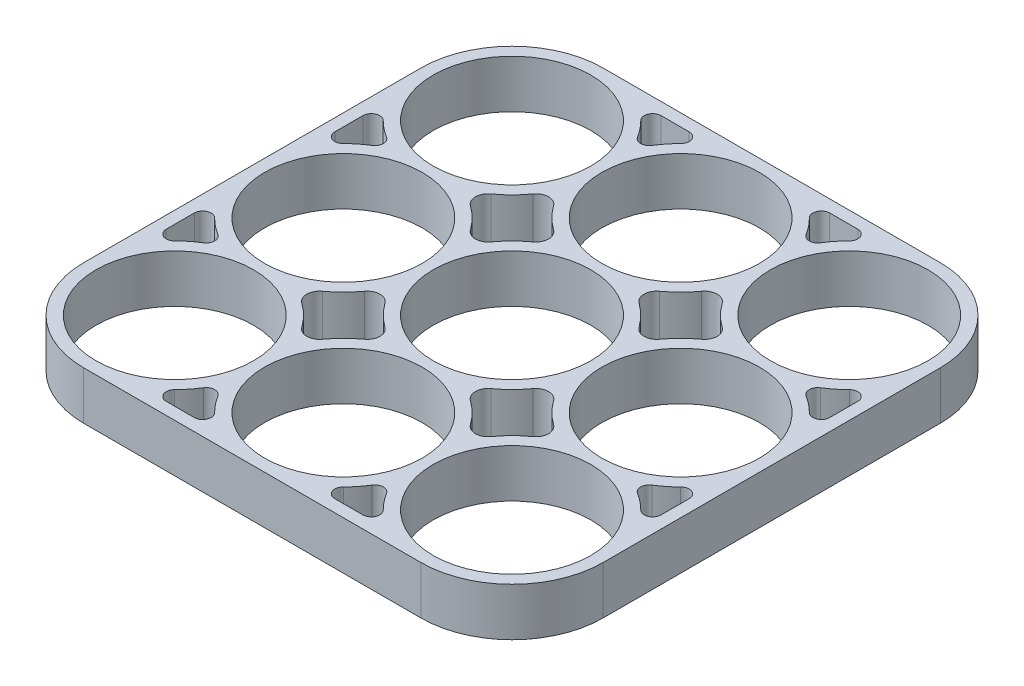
SolidWorks part; units mm, degrees
ref_plane "Ebene vorne" through (0, 0, 0) normal (0, 0, 1) x (1, 0, 0)
ref_plane "Ebene oben" through (0, 0, 0) normal (0, 1, 0) x (1, 0, 0)
ref_plane "Ebene rechts" through (0, 0, 0) normal (1, 0, 0) x (0, 0, -1)
sketch "Skizze1" plane through (0, 0, 0) normal (0, 1, 0) x (1, 0, 0)
  line L0 (-50, 0) -> (50, 0) construction
  line L1 (0, -50) -> (0, 50) construction
  line L2 (-30.8, 20) -> (-30.8, -20)
  line L3 (-30.8, -20) -> (-29.35, -20)
  line L4 (-29.35, 11.6623) -> (-29.35, 8.3377)
  line L5 (-29.35, -8.3377) -> (-29.35, -11.6623)
  line L6 (-20, -30.8) -> (20, -30.8)
  line L7 (-11.6623, -29.35) -> (-8.3377, -29.35)
  line L8 (8.3377, -29.35) -> (11.6623, -29.35)
  line L9 (-20, 30.8) -> (20, 30.8)
  line L10 (-11.6623, 29.35) -> (-8.3377, 29.35)
  line L11 (8.3377, 29.35) -> (11.6623, 29.35)
  line L12 (30.8, 20) -> (30.8, -20)
  line L14 (29.35, -11.6623) -> (29.35, -8.3377)
  line L15 (29.35, 8.3377) -> (29.35, 11.6623)
  arc A1 (-13.7117, -8.7805) -> (-11.2195, -6.2883) centre (-20, 0) ccw
  arc A2 (-25.7333, -10.8475) -> (-27.6424, -12.3689) centre (-20, -20) ccw
  arc A3 (6.2883, 11.2195) -> (8.7805, 13.7117) centre (0, 20) ccw
  arc A4 (6.2883, -8.7805) -> (8.7805, -6.2883) centre (0, 0) ccw
  arc A5 (-9.1525, -25.7333) -> (-7.6311, -27.6424) centre (0, -20) ccw
  arc A6 (11.2195, 13.7117) -> (13.7117, 11.2195) centre (20, 20) ccw
  arc A7 (25.7333, -9.1525) -> (27.6424, -7.6311) centre (20, 0) ccw
  arc A8 (10.8475, -25.7333) -> (12.3689, -27.6424) centre (20, -20) ccw
  circle A9 centre (-20, 20) radius 9.35
  circle A10 centre (-20, 0) radius 9.35
  circle A11 centre (-20, -20) radius 9.35
  circle A12 centre (0, -20) radius 9.35
  circle A13 centre (0, 0) radius 9.35
  circle A14 centre (0, 20) radius 9.35
  circle A15 centre (20, 20) radius 9.35
  circle A16 centre (20, 0) radius 9.35
  circle A17 centre (20, -20) radius 9.35
  arc A18 (-11.2195, -13.7117) -> (-13.7117, -11.2195) centre (-20, -20) ccw
  arc A19 (8.7805, -13.7117) -> (6.2883, -11.2195) centre (0, -20) ccw
  arc A20 (13.7117, -11.2195) -> (11.2195, -13.7117) centre (20, -20) ccw
  arc A21 (-6.2883, -11.2195) -> (-8.7805, -13.7117) centre (0, -20) ccw
  arc A22 (-25.7333, 9.1525) -> (-27.6424, 7.6311) centre (-20, 0) ccw
  arc A23 (-13.7117, 11.2195) -> (-11.2195, 13.7117) centre (-20, 20) ccw
  arc A24 (-11.2195, 6.2883) -> (-13.7117, 8.7805) centre (-20, 0) ccw
  arc A25 (-8.7805, -6.2883) -> (-6.2883, -8.7805) centre (0, 0) ccw
  arc A26 (8.7805, 6.2883) -> (6.2883, 8.7805) centre (0, 0) ccw
  arc A27 (11.2195, -6.2883) -> (13.7117, -8.7805) centre (20, 0) ccw
  arc A28 (-6.2883, 8.7805) -> (-8.7805, 6.2883) centre (0, 0) ccw
  arc A29 (-10.8475, 25.7333) -> (-12.3689, 27.6424) centre (-20, 20) ccw
  arc A30 (-8.7805, 13.7117) -> (-6.2883, 11.2195) centre (0, 20) ccw
  arc A31 (9.1525, 25.7333) -> (7.6311, 27.6424) centre (0, 20) ccw
  arc A32 (13.7117, 8.7805) -> (11.2195, 6.2883) centre (20, 0) ccw
  arc A33 (25.7333, 10.8475) -> (27.6424, 12.3689) centre (20, 20) ccw
  arc A34 (-27.6424, 12.3689) -> (-25.7333, 10.8475) centre (-20, 20) ccw
  arc A35 (-27.6424, -7.6311) -> (-25.7333, -9.1525) centre (-20, 0) ccw
  arc A36 (-30.8, -20) -> (-20, -30.8) centre (-20, -20) ccw
  arc A37 (-12.3689, -27.6424) -> (-10.8475, -25.7333) centre (-20, -20) ccw
  arc A38 (7.6311, -27.6424) -> (9.1525, -25.7333) centre (0, -20) ccw
  arc A39 (20, -30.8) -> (30.8, -20) centre (20, -20) ccw
  arc A40 (-20, 30.8) -> (-30.8, 20) centre (-20, 20) ccw
  arc A41 (-7.6311, 27.6424) -> (-9.1525, 25.7333) centre (0, 20) ccw
  arc A42 (12.3689, 27.6424) -> (10.8475, 25.7333) centre (20, 20) ccw
  arc A43 (30.8, 20) -> (20, 30.8) centre (20, 20) ccw
  arc A44 (27.6424, 7.6311) -> (25.7333, 9.1525) centre (20, 0) ccw
  arc A45 (27.6424, -12.3689) -> (25.7333, -10.8475) centre (20, -20) ccw
  arc A46 (9.1525, 25.7333) -> (10.8475, 25.7333) centre (10, 26.2642) ccw
  arc A47 (12.3689, 27.6424) -> (11.6623, 29.35) centre (11.6623, 28.35) ccw
  arc A48 (8.3377, 29.35) -> (7.6311, 27.6424) centre (8.3377, 28.35) ccw
  arc A49 (-11.6623, 29.35) -> (-12.3689, 27.6424) centre (-11.6623, 28.35) ccw
  arc A50 (-7.6311, 27.6424) -> (-8.3377, 29.35) centre (-8.3377, 28.35) ccw
  arc A51 (-9.1525, 25.7333) -> (-10.8475, 25.7333) centre (-10, 26.2642) cw
  arc A52 (27.6424, 7.6311) -> (29.35, 8.3377) centre (28.35, 8.3377) ccw
  arc A53 (29.35, 11.6623) -> (27.6424, 12.3689) centre (28.35, 11.6623) ccw
  arc A54 (25.7333, 10.8475) -> (25.7333, 9.1525) centre (26.2642, 10) ccw
  arc A55 (27.6424, -12.3689) -> (29.35, -11.6623) centre (28.35, -11.6623) ccw
  arc A56 (29.35, -8.3377) -> (27.6424, -7.6311) centre (28.35, -8.3377) ccw
  arc A57 (25.7333, -10.8475) -> (25.7333, -9.1525) centre (26.2642, -10) cw
  arc A58 (-8.3377, -29.35) -> (-7.6311, -27.6424) centre (-8.3377, -28.35) ccw
  arc A59 (-11.6623, -29.35) -> (-12.3689, -27.6424) centre (-11.6623, -28.35) cw
  arc A60 (8.3377, -29.35) -> (7.6311, -27.6424) centre (8.3377, -28.35) cw
  arc A61 (11.6623, -29.35) -> (12.3689, -27.6424) centre (11.6623, -28.35) ccw
  arc A62 (10.8475, -25.7333) -> (9.1525, -25.7333) centre (10, -26.2642) ccw
  arc A63 (-9.1525, -25.7333) -> (-10.8475, -25.7333) centre (-10, -26.2642) ccw
  arc A64 (-27.6424, -12.3689) -> (-29.35, -11.6623) centre (-28.35, -11.6623) cw
  arc A65 (-25.7333, -10.8475) -> (-25.7333, -9.1525) centre (-26.2642, -10) ccw
  arc A66 (-27.6424, -7.6311) -> (-29.35, -8.3377) centre (-28.35, -8.3377) ccw
  arc A67 (-27.6424, 7.6311) -> (-29.35, 8.3377) centre (-28.35, 8.3377) cw
  arc A68 (-25.7333, 9.1525) -> (-25.7333, 10.8475) centre (-26.2642, 10) ccw
  arc A69 (-29.35, 11.6623) -> (-27.6424, 12.3689) centre (-28.35, 11.6623) cw
  arc A70 (11.2195, -13.7117) -> (8.7805, -13.7117) centre (10, -12.8383) cw
  arc A71 (13.7117, -11.2195) -> (13.7117, -8.7805) centre (12.8383, -10) ccw
  arc A72 (6.2883, -11.2195) -> (6.2883, -8.7805) centre (7.1617, -10) cw
  arc A73 (11.2195, 6.2883) -> (8.7805, 6.2883) centre (10, 7.1617) cw
  arc A74 (13.7117, 8.7805) -> (13.7117, 11.2195) centre (12.8383, 10) ccw
  arc A75 (6.2883, 8.7805) -> (6.2883, 11.2195) centre (7.1617, 10) cw
  arc A76 (11.2195, 13.7117) -> (8.7805, 13.7117) centre (10, 12.8383) ccw
  arc A77 (11.2195, -6.2883) -> (8.7805, -6.2883) centre (10, -7.1617) ccw
  arc A78 (-6.2883, -11.2195) -> (-6.2883, -8.7805) centre (-7.1617, -10) ccw
  arc A79 (-13.7117, -11.2195) -> (-13.7117, -8.7805) centre (-12.8383, -10) cw
  arc A80 (-8.7805, -13.7117) -> (-11.2195, -13.7117) centre (-10, -12.8383) cw
  arc A81 (-11.2195, 6.2883) -> (-8.7805, 6.2883) centre (-10, 7.1617) ccw
  arc A82 (-6.2883, 8.7805) -> (-6.2883, 11.2195) centre (-7.1617, 10) ccw
  arc A83 (-13.7117, 8.7805) -> (-13.7117, 11.2195) centre (-12.8383, 10) cw
  arc A84 (-8.7805, -6.2883) -> (-11.2195, -6.2883) centre (-10, -7.1617) ccw
  arc A85 (-8.7805, 13.7117) -> (-11.2195, 13.7117) centre (-10, 12.8383) ccw
  point P85 (29.35, 5.4053)
  point P90 (24.0792, 10)
  point P101 (-14.5947, -29.35)
  point P122 (-29.35, 14.5947)
  dimension "D1" = 18.7
  dimension "D2" = 10.8
  dimension "D7" = 10.8
  dimension "D8" = 10.8
  dimension "D9" = 1
  dimension "D10" = 1.5
  dimension "D3" = 20
  dimension "D4" = 20
  dimension "D5" = 20
  dimension "D6" = 20
extrude "Aufsatz-Linear austragen1" add sketch "Skizze1" along normal blind 5.7
